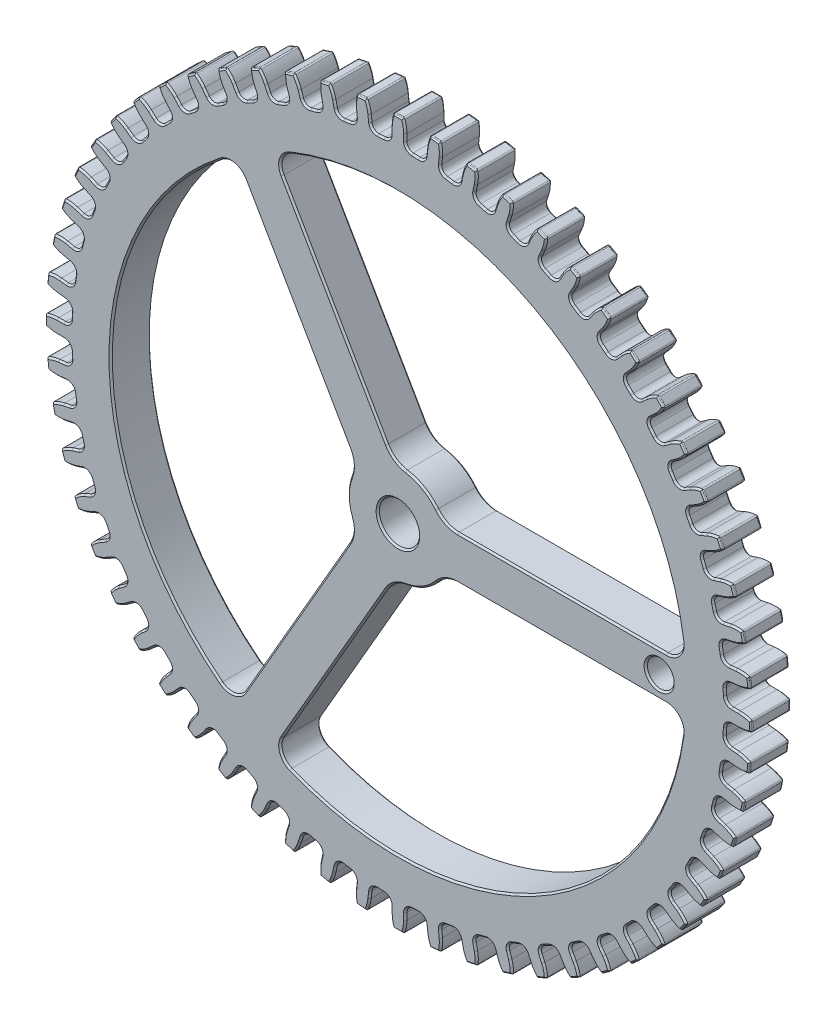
SolidWorks part; units mm, degrees
ref_plane "Спереди" through (0, 0, 0) normal (0, 0, 1) x (1, 0, 0)
ref_plane "Сверху" through (0, 0, 0) normal (0, 1, 0) x (1, 0, 0)
ref_plane "Справа" through (0, 0, 0) normal (1, 0, 0) x (0, 0, -1)
sketch "Эскиз1" plane through (0, 0, 0) normal (0, 0, 1) x (1, 0, 0)
  line L0 (0, 0) -> (0, 52.7) construction
  line L1 (0, 0) -> (-24.4375, 42.327) construction
  line L2 (-7.278, 6.1058) -> (-22.8555, 33.0868)
  line L3 (8.9268, 3.25) -> (40.0817, 3.25)
  line L4 (-1.6488, 9.3558) -> (-17.2263, 36.3368)
  line L5 (8.9268, -3.25) -> (40.0817, -3.25)
  line L6 (-1.6488, -9.3558) -> (-17.2263, -36.3368)
  line L7 (-7.278, -6.1058) -> (-22.8555, -33.0868)
  line L8 (0, 0) -> (42.878, 0) construction
  line L9 (0, 0) -> (-21.439, -37.1334) construction
  line L11 (-1.1, 49.8308) -> (-1.1, 50.8507)
  line L12 (1.1, 49.8308) -> (1.1, 50.8507)
  line L13 (4.1148, 49.6728) -> (4.2214, 50.6871)
  line L14 (6.3027, 49.4428) -> (6.4093, 50.4571)
  line L15 (9.2844, 48.9706) -> (9.4965, 49.9682)
  line L16 (11.4364, 48.5131) -> (11.6484, 49.5108)
  line L17 (14.3524, 47.7318) -> (14.6676, 48.7018)
  line L18 (16.4447, 47.052) -> (16.7599, 48.0219)
  line L19 (19.2631, 45.9701) -> (19.6779, 46.9018)
  line L20 (21.2729, 45.0753) -> (21.6877, 46.007)
  line L21 (23.9628, 43.7047) -> (24.4727, 44.588)
  line L22 (25.868, 42.6047) -> (26.378, 43.488)
  line L23 (28.3999, 40.9605) -> (28.9994, 41.7856)
  line L24 (30.1797, 39.6674) -> (30.7792, 40.4925)
  line L25 (32.5258, 37.7675) -> (33.2083, 38.5255)
  line L26 (34.1608, 36.2954) -> (34.8432, 37.0534)
  line L27 (36.2954, 34.1608) -> (37.0534, 34.8432)
  line L28 (37.7675, 32.5258) -> (38.5255, 33.2083)
  line L29 (39.6674, 30.1797) -> (40.4925, 30.7792)
  line L30 (40.9605, 28.3999) -> (41.7856, 28.9994)
  line L31 (42.6047, 25.868) -> (43.488, 26.378)
  line L32 (43.7047, 23.9628) -> (44.588, 24.4727)
  line L33 (45.0753, 21.2729) -> (46.007, 21.6877)
  line L34 (45.9701, 19.2631) -> (46.9018, 19.6779)
  line L35 (47.052, 16.4447) -> (48.0219, 16.7599)
  line L36 (47.7318, 14.3524) -> (48.7018, 14.6676)
  line L37 (48.5131, 11.4364) -> (49.5108, 11.6484)
  line L38 (48.9706, 9.2844) -> (49.9682, 9.4965)
  line L39 (49.4428, 6.3027) -> (50.4571, 6.4093)
  line L40 (49.6728, 4.1148) -> (50.6871, 4.2214)
  line L41 (49.8308, 1.1) -> (50.8507, 1.1)
  line L42 (49.8308, -1.1) -> (50.8507, -1.1)
  line L43 (49.6728, -4.1148) -> (50.6871, -4.2214)
  line L44 (49.4428, -6.3027) -> (50.4571, -6.4093)
  line L45 (48.9706, -9.2844) -> (49.9682, -9.4965)
  line L46 (48.5131, -11.4364) -> (49.5108, -11.6484)
  line L47 (47.7318, -14.3524) -> (48.7018, -14.6676)
  line L48 (47.052, -16.4447) -> (48.0219, -16.7599)
  line L49 (45.9701, -19.2631) -> (46.9018, -19.6779)
  line L50 (45.0753, -21.2729) -> (46.007, -21.6877)
  line L51 (43.7047, -23.9628) -> (44.588, -24.4727)
  line L52 (42.6047, -25.868) -> (43.488, -26.378)
  line L53 (40.9605, -28.3999) -> (41.7856, -28.9994)
  line L54 (39.6674, -30.1797) -> (40.4925, -30.7792)
  line L55 (37.7675, -32.5258) -> (38.5255, -33.2083)
  line L56 (36.2954, -34.1608) -> (37.0534, -34.8432)
  line L57 (34.1608, -36.2954) -> (34.8432, -37.0534)
  line L58 (32.5258, -37.7675) -> (33.2083, -38.5255)
  line L59 (30.1797, -39.6674) -> (30.7792, -40.4925)
  line L60 (28.3999, -40.9605) -> (28.9994, -41.7856)
  line L61 (25.868, -42.6047) -> (26.378, -43.488)
  line L62 (23.9628, -43.7047) -> (24.4727, -44.588)
  line L63 (21.2729, -45.0753) -> (21.6877, -46.007)
  line L64 (19.2631, -45.9701) -> (19.6779, -46.9018)
  line L65 (16.4447, -47.052) -> (16.7599, -48.0219)
  line L66 (14.3524, -47.7318) -> (14.6676, -48.7018)
  line L67 (11.4364, -48.5131) -> (11.6484, -49.5108)
  line L68 (9.2844, -48.9706) -> (9.4965, -49.9682)
  line L69 (6.3027, -49.4428) -> (6.4093, -50.4571)
  line L70 (4.1148, -49.6728) -> (4.2214, -50.6871)
  line L71 (1.1, -49.8308) -> (1.1, -50.8507)
  line L72 (-1.1, -49.8308) -> (-1.1, -50.8507)
  line L73 (-4.1148, -49.6728) -> (-4.2214, -50.6871)
  line L74 (-6.3027, -49.4428) -> (-6.4093, -50.4571)
  line L75 (-9.2844, -48.9706) -> (-9.4965, -49.9682)
  line L76 (-11.4364, -48.5131) -> (-11.6484, -49.5108)
  line L77 (-14.3524, -47.7318) -> (-14.6676, -48.7018)
  line L78 (-16.4447, -47.052) -> (-16.7599, -48.0219)
  line L79 (-19.2631, -45.9701) -> (-19.6779, -46.9018)
  line L80 (-21.2729, -45.0753) -> (-21.6877, -46.007)
  line L81 (-23.9628, -43.7047) -> (-24.4727, -44.588)
  line L82 (-25.868, -42.6047) -> (-26.378, -43.488)
  line L83 (-28.3999, -40.9605) -> (-28.9994, -41.7856)
  line L84 (-30.1797, -39.6674) -> (-30.7792, -40.4925)
  line L85 (-32.5258, -37.7675) -> (-33.2083, -38.5255)
  line L86 (-34.1608, -36.2954) -> (-34.8432, -37.0534)
  line L87 (-36.2954, -34.1608) -> (-37.0534, -34.8432)
  line L88 (-37.7675, -32.5258) -> (-38.5255, -33.2083)
  line L89 (-39.6674, -30.1797) -> (-40.4925, -30.7792)
  line L90 (-40.9605, -28.3999) -> (-41.7856, -28.9994)
  line L91 (-42.6047, -25.868) -> (-43.488, -26.378)
  line L92 (-43.7047, -23.9628) -> (-44.588, -24.4727)
  line L93 (-45.0753, -21.2729) -> (-46.007, -21.6877)
  line L94 (-45.9701, -19.2631) -> (-46.9018, -19.6779)
  line L95 (-47.052, -16.4447) -> (-48.0219, -16.7599)
  line L96 (-47.7318, -14.3524) -> (-48.7018, -14.6676)
  line L97 (-48.5131, -11.4364) -> (-49.5108, -11.6484)
  line L98 (-48.9706, -9.2844) -> (-49.9682, -9.4965)
  line L99 (-49.4428, -6.3027) -> (-50.4571, -6.4093)
  line L100 (-49.6728, -4.1148) -> (-50.6871, -4.2214)
  line L101 (-49.8308, -1.1) -> (-50.8507, -1.1)
  line L102 (-49.8308, 1.1) -> (-50.8507, 1.1)
  line L103 (-49.6728, 4.1148) -> (-50.6871, 4.2214)
  line L104 (-49.4428, 6.3027) -> (-50.4571, 6.4093)
  line L105 (-48.9706, 9.2844) -> (-49.9682, 9.4965)
  line L106 (-48.5131, 11.4364) -> (-49.5108, 11.6484)
  line L107 (-47.7318, 14.3524) -> (-48.7018, 14.6676)
  line L108 (-47.052, 16.4447) -> (-48.0219, 16.7599)
  line L109 (-45.9701, 19.2631) -> (-46.9018, 19.6779)
  line L110 (-45.0753, 21.2729) -> (-46.007, 21.6877)
  line L111 (-43.7047, 23.9628) -> (-44.588, 24.4727)
  line L112 (-42.6047, 25.868) -> (-43.488, 26.378)
  line L113 (-40.9605, 28.3999) -> (-41.7856, 28.9994)
  line L114 (-39.6674, 30.1797) -> (-40.4925, 30.7792)
  line L115 (-37.7675, 32.5258) -> (-38.5255, 33.2083)
  line L116 (-36.2954, 34.1608) -> (-37.0534, 34.8432)
  line L117 (-34.1608, 36.2954) -> (-34.8432, 37.0534)
  line L118 (-32.5258, 37.7675) -> (-33.2083, 38.5255)
  line L119 (-30.1797, 39.6674) -> (-30.7792, 40.4925)
  line L120 (-28.3999, 40.9605) -> (-28.9994, 41.7856)
  line L121 (-25.868, 42.6047) -> (-26.378, 43.488)
  line L122 (-23.9628, 43.7047) -> (-24.4727, 44.588)
  line L123 (-21.2729, 45.0753) -> (-21.6877, 46.007)
  line L124 (-19.2631, 45.9701) -> (-19.6779, 46.9018)
  line L125 (-16.4447, 47.052) -> (-16.7599, 48.0219)
  line L126 (-14.3524, 47.7318) -> (-14.6676, 48.7018)
  line L127 (-11.4364, 48.5131) -> (-11.6484, 49.5108)
  line L128 (-9.2844, 48.9706) -> (-9.4965, 49.9682)
  line L129 (-6.3027, 49.4428) -> (-6.4093, 50.4571)
  line L130 (-4.1148, 49.6728) -> (-4.2214, 50.6871)
  arc A0 (0.7475, 52.6947) -> (-0.7475, 52.6947) centre (0, 0) ccw
  circle A1 centre (0, 0) radius 51 construction
  arc A2 (-2.0579, 48.8317) -> (-3.0577, 48.7793) centre (0, 0) ccw
  circle A3 centre (0, 0) radius 3
  arc A4 (1.1839, -7.406) -> (5.8218, -4.7283) centre (0, 0) ccw
  arc A5 (42.4582, 5.985) -> (-16.046, 39.7624) centre (0, 0) ccw
  arc A6 (-7.0057, 2.6777) -> (-7.0057, -2.6777) centre (0, 0) ccw
  arc A7 (5.8218, 4.7283) -> (1.1839, 7.406) centre (0, 0) ccw
  arc A8 (-16.046, -39.7624) -> (42.4582, -5.985) centre (0, 0) ccw
  arc A9 (-26.4123, 33.7774) -> (-26.4123, -33.7774) centre (0, 0) ccw
  arc A10 (-22.8555, -33.0868) -> (-26.4123, -33.7774) centre (-24.9339, -31.8868) cw
  arc A11 (-17.2263, -36.3368) -> (-16.046, -39.7624) centre (-15.1478, -37.5368) ccw
  arc A12 (40.0817, -3.25) -> (42.4582, -5.985) centre (40.0817, -5.65) cw
  arc A13 (40.0817, 3.25) -> (42.4582, 5.985) centre (40.0817, 5.65) ccw
  arc A14 (-17.2263, 36.3368) -> (-16.046, 39.7624) centre (-15.1478, 37.5368) cw
  arc A15 (-22.8555, 33.0868) -> (-26.4123, 33.7774) centre (-24.9339, 31.8868) ccw
  arc A16 (-1.6488, -9.3558) -> (1.1839, -7.406) centre (1.8153, -11.3558) cw
  arc A17 (8.9268, -3.25) -> (5.8218, -4.7283) centre (8.9268, -7.25) ccw
  arc A18 (-7.278, -6.1058) -> (-7.0057, -2.6777) centre (-10.7421, -4.1058) ccw
  arc A19 (-7.278, 6.1058) -> (-7.0057, 2.6777) centre (-10.7421, 4.1058) cw
  arc A20 (-1.6488, 9.3558) -> (1.1839, 7.406) centre (1.8153, 11.3558) ccw
  arc A21 (8.9268, 3.25) -> (5.8218, 4.7283) centre (8.9268, 7.25) cw
  arc A22 (-0.7475, 52.6947) -> (-1.1, 50.8507) centre (3.9, 50.8507) ccw
  arc A23 (0.7475, 52.6947) -> (1.1, 50.8507) centre (-3.9, 50.8507) cw
  arc A24 (6.2515, 52.3279) -> (4.7647, 52.4842) centre (0, 0) ccw
  arc A25 (4.7647, 52.4842) -> (4.2214, 50.6871) centre (9.194, 50.1644) ccw
  arc A26 (6.2515, 52.3279) -> (6.4093, 50.4571) centre (1.4367, 50.9798) cw
  arc A27 (11.687, 51.3878) -> (10.2246, 51.6986) centre (0, 0) ccw
  arc A28 (10.2246, 51.6986) -> (9.4965, 49.9682) centre (14.3872, 48.9286) ccw
  arc A29 (11.687, 51.3878) -> (11.6484, 49.5108) centre (6.7577, 50.5503) cw
  arc A30 (16.9945, 49.8846) -> (15.5726, 50.3466) centre (0, 0) ccw
  arc A31 (15.5726, 50.3466) -> (14.6676, 48.7018) centre (19.4228, 47.1567) ccw
  arc A32 (16.9945, 49.8846) -> (16.7599, 48.0219) centre (12.0046, 49.567) cw
  arc A33 (22.1158, 47.835) -> (20.75, 48.443) centre (0, 0) ccw
  arc A34 (20.75, 48.443) -> (19.6779, 46.9018) centre (24.2457, 44.8681) ccw
  arc A35 (22.1158, 47.835) -> (21.6877, 46.007) centre (17.12, 48.0407) cw
  arc A36 (26.9947, 45.2612) -> (25.7, 46.0087) centre (0, 0) ccw
  arc A37 (25.7, 46.0087) -> (24.4727, 44.588) centre (28.8028, 42.088) ccw
  arc A38 (26.9947, 45.2612) -> (26.378, 43.488) centre (22.0478, 45.988) cw
  arc A39 (31.5779, 42.1915) -> (30.3684, 43.0703) centre (0, 0) ccw
  arc A40 (30.3684, 43.0703) -> (28.9994, 41.7856) centre (33.0444, 38.8467) ccw
  arc A41 (31.5779, 42.1915) -> (30.7792, 40.4925) centre (26.7341, 43.4314) cw
  arc A42 (35.8152, 38.6596) -> (34.7041, 39.66) centre (0, 0) ccw
  arc A43 (34.7041, 39.66) -> (33.2083, 38.5255) centre (36.924, 35.1798) ccw
  arc A44 (35.8152, 38.6596) -> (34.8432, 37.0534) centre (31.1275, 40.399) cw
  arc A45 (39.66, 34.7041) -> (38.6596, 35.8152) centre (0, 0) ccw
  arc A46 (38.6596, 35.8152) -> (37.0534, 34.8432) centre (40.399, 31.1275) ccw
  arc A47 (39.66, 34.7041) -> (38.5255, 33.2083) centre (35.1798, 36.924) cw
  arc A48 (43.0703, 30.3684) -> (42.1915, 31.5779) centre (0, 0) ccw
  arc A49 (42.1915, 31.5779) -> (40.4925, 30.7792) centre (43.4314, 26.7341) ccw
  arc A50 (43.0703, 30.3684) -> (41.7856, 28.9994) centre (38.8467, 33.0444) cw
  arc A51 (46.0087, 25.7) -> (45.2612, 26.9947) centre (0, 0) ccw
  arc A52 (45.2612, 26.9947) -> (43.488, 26.378) centre (45.988, 22.0478) ccw
  arc A53 (46.0087, 25.7) -> (44.588, 24.4727) centre (42.088, 28.8028) cw
  arc A54 (48.443, 20.75) -> (47.835, 22.1158) centre (0, 0) ccw
  arc A55 (47.835, 22.1158) -> (46.007, 21.6877) centre (48.0407, 17.12) ccw
  arc A56 (48.443, 20.75) -> (46.9018, 19.6779) centre (44.8681, 24.2457) cw
  arc A57 (50.3466, 15.5726) -> (49.8846, 16.9945) centre (0, 0) ccw
  arc A58 (49.8846, 16.9945) -> (48.0219, 16.7599) centre (49.567, 12.0046) ccw
  arc A59 (50.3466, 15.5726) -> (48.7018, 14.6676) centre (47.1567, 19.4228) cw
  arc A60 (51.6986, 10.2246) -> (51.3878, 11.687) centre (0, 0) ccw
  arc A61 (51.3878, 11.687) -> (49.5108, 11.6484) centre (50.5503, 6.7577) ccw
  arc A62 (51.6986, 10.2246) -> (49.9682, 9.4965) centre (48.9286, 14.3872) cw
  arc A63 (52.4842, 4.7647) -> (52.3279, 6.2515) centre (0, 0) ccw
  arc A64 (52.3279, 6.2515) -> (50.4571, 6.4093) centre (50.9798, 1.4367) ccw
  arc A65 (52.4842, 4.7647) -> (50.6871, 4.2214) centre (50.1644, 9.194) cw
  arc A66 (52.6947, -0.7475) -> (52.6947, 0.7475) centre (0, 0) ccw
  arc A67 (52.6947, 0.7475) -> (50.8507, 1.1) centre (50.8507, -3.9) ccw
  arc A68 (52.6947, -0.7475) -> (50.8507, -1.1) centre (50.8507, 3.9) cw
  arc A69 (52.3279, -6.2515) -> (52.4842, -4.7647) centre (0, 0) ccw
  arc A70 (52.4842, -4.7647) -> (50.6871, -4.2214) centre (50.1644, -9.194) ccw
  arc A71 (52.3279, -6.2515) -> (50.4571, -6.4093) centre (50.9798, -1.4367) cw
  arc A72 (51.3878, -11.687) -> (51.6986, -10.2246) centre (0, 0) ccw
  arc A73 (51.6986, -10.2246) -> (49.9682, -9.4965) centre (48.9286, -14.3872) ccw
  arc A74 (51.3878, -11.687) -> (49.5108, -11.6484) centre (50.5503, -6.7577) cw
  arc A75 (49.8846, -16.9945) -> (50.3466, -15.5726) centre (0, 0) ccw
  arc A76 (50.3466, -15.5726) -> (48.7018, -14.6676) centre (47.1567, -19.4228) ccw
  arc A77 (49.8846, -16.9945) -> (48.0219, -16.7599) centre (49.567, -12.0046) cw
  arc A78 (47.835, -22.1158) -> (48.443, -20.75) centre (0, 0) ccw
  arc A79 (48.443, -20.75) -> (46.9018, -19.6779) centre (44.8681, -24.2457) ccw
  arc A80 (47.835, -22.1158) -> (46.007, -21.6877) centre (48.0407, -17.12) cw
  arc A81 (45.2612, -26.9947) -> (46.0087, -25.7) centre (0, 0) ccw
  arc A82 (46.0087, -25.7) -> (44.588, -24.4727) centre (42.088, -28.8028) ccw
  arc A83 (45.2612, -26.9947) -> (43.488, -26.378) centre (45.988, -22.0478) cw
  arc A84 (42.1915, -31.5779) -> (43.0703, -30.3684) centre (0, 0) ccw
  arc A85 (43.0703, -30.3684) -> (41.7856, -28.9994) centre (38.8467, -33.0444) ccw
  arc A86 (42.1915, -31.5779) -> (40.4925, -30.7792) centre (43.4314, -26.7341) cw
  arc A87 (38.6596, -35.8152) -> (39.66, -34.7041) centre (0, 0) ccw
  arc A88 (39.66, -34.7041) -> (38.5255, -33.2083) centre (35.1798, -36.924) ccw
  arc A89 (38.6596, -35.8152) -> (37.0534, -34.8432) centre (40.399, -31.1275) cw
  arc A90 (34.7041, -39.66) -> (35.8152, -38.6596) centre (0, 0) ccw
  arc A91 (35.8152, -38.6596) -> (34.8432, -37.0534) centre (31.1275, -40.399) ccw
  arc A92 (34.7041, -39.66) -> (33.2083, -38.5255) centre (36.924, -35.1798) cw
  arc A93 (30.3684, -43.0703) -> (31.5779, -42.1915) centre (0, 0) ccw
  arc A94 (31.5779, -42.1915) -> (30.7792, -40.4925) centre (26.7341, -43.4314) ccw
  arc A95 (30.3684, -43.0703) -> (28.9994, -41.7856) centre (33.0444, -38.8467) cw
  arc A96 (25.7, -46.0087) -> (26.9947, -45.2612) centre (0, 0) ccw
  arc A97 (26.9947, -45.2612) -> (26.378, -43.488) centre (22.0478, -45.988) ccw
  arc A98 (25.7, -46.0087) -> (24.4727, -44.588) centre (28.8028, -42.088) cw
  arc A99 (20.75, -48.443) -> (22.1158, -47.835) centre (0, 0) ccw
  arc A100 (22.1158, -47.835) -> (21.6877, -46.007) centre (17.12, -48.0407) ccw
  arc A101 (20.75, -48.443) -> (19.6779, -46.9018) centre (24.2457, -44.8681) cw
  arc A102 (15.5726, -50.3466) -> (16.9945, -49.8846) centre (0, 0) ccw
  arc A103 (16.9945, -49.8846) -> (16.7599, -48.0219) centre (12.0046, -49.567) ccw
  arc A104 (15.5726, -50.3466) -> (14.6676, -48.7018) centre (19.4228, -47.1567) cw
  arc A105 (10.2246, -51.6986) -> (11.687, -51.3878) centre (0, 0) ccw
  arc A106 (11.687, -51.3878) -> (11.6484, -49.5108) centre (6.7577, -50.5503) ccw
  arc A107 (10.2246, -51.6986) -> (9.4965, -49.9682) centre (14.3872, -48.9286) cw
  arc A108 (4.7647, -52.4842) -> (6.2515, -52.3279) centre (0, 0) ccw
  arc A109 (6.2515, -52.3279) -> (6.4093, -50.4571) centre (1.4367, -50.9798) ccw
  arc A110 (4.7647, -52.4842) -> (4.2214, -50.6871) centre (9.194, -50.1644) cw
  arc A111 (-0.7475, -52.6947) -> (0.7475, -52.6947) centre (0, 0) ccw
  arc A112 (0.7475, -52.6947) -> (1.1, -50.8507) centre (-3.9, -50.8507) ccw
  arc A113 (-0.7475, -52.6947) -> (-1.1, -50.8507) centre (3.9, -50.8507) cw
  arc A114 (-6.2515, -52.3279) -> (-4.7647, -52.4842) centre (0, 0) ccw
  arc A115 (-4.7647, -52.4842) -> (-4.2214, -50.6871) centre (-9.194, -50.1644) ccw
  arc A116 (-6.2515, -52.3279) -> (-6.4093, -50.4571) centre (-1.4367, -50.9798) cw
  arc A117 (-11.687, -51.3878) -> (-10.2246, -51.6986) centre (0, 0) ccw
  arc A118 (-10.2246, -51.6986) -> (-9.4965, -49.9682) centre (-14.3872, -48.9286) ccw
  arc A119 (-11.687, -51.3878) -> (-11.6484, -49.5108) centre (-6.7577, -50.5503) cw
  arc A120 (-16.9945, -49.8846) -> (-15.5726, -50.3466) centre (0, 0) ccw
  arc A121 (-15.5726, -50.3466) -> (-14.6676, -48.7018) centre (-19.4228, -47.1567) ccw
  arc A122 (-16.9945, -49.8846) -> (-16.7599, -48.0219) centre (-12.0046, -49.567) cw
  arc A123 (-22.1158, -47.835) -> (-20.75, -48.443) centre (0, 0) ccw
  arc A124 (-20.75, -48.443) -> (-19.6779, -46.9018) centre (-24.2457, -44.8681) ccw
  arc A125 (-22.1158, -47.835) -> (-21.6877, -46.007) centre (-17.12, -48.0407) cw
  arc A126 (-26.9947, -45.2612) -> (-25.7, -46.0087) centre (0, 0) ccw
  arc A127 (-25.7, -46.0087) -> (-24.4727, -44.588) centre (-28.8028, -42.088) ccw
  arc A128 (-26.9947, -45.2612) -> (-26.378, -43.488) centre (-22.0478, -45.988) cw
  arc A129 (-31.5779, -42.1915) -> (-30.3684, -43.0703) centre (0, 0) ccw
  arc A130 (-30.3684, -43.0703) -> (-28.9994, -41.7856) centre (-33.0444, -38.8467) ccw
  arc A131 (-31.5779, -42.1915) -> (-30.7792, -40.4925) centre (-26.7341, -43.4314) cw
  arc A132 (-35.8152, -38.6596) -> (-34.7041, -39.66) centre (0, 0) ccw
  arc A133 (-34.7041, -39.66) -> (-33.2083, -38.5255) centre (-36.924, -35.1798) ccw
  arc A134 (-35.8152, -38.6596) -> (-34.8432, -37.0534) centre (-31.1275, -40.399) cw
  arc A135 (-39.66, -34.7041) -> (-38.6596, -35.8152) centre (0, 0) ccw
  arc A136 (-38.6596, -35.8152) -> (-37.0534, -34.8432) centre (-40.399, -31.1275) ccw
  arc A137 (-39.66, -34.7041) -> (-38.5255, -33.2083) centre (-35.1798, -36.924) cw
  arc A138 (-43.0703, -30.3684) -> (-42.1915, -31.5779) centre (0, 0) ccw
  arc A139 (-42.1915, -31.5779) -> (-40.4925, -30.7792) centre (-43.4314, -26.7341) ccw
  arc A140 (-43.0703, -30.3684) -> (-41.7856, -28.9994) centre (-38.8467, -33.0444) cw
  arc A141 (-46.0087, -25.7) -> (-45.2612, -26.9947) centre (0, 0) ccw
  arc A142 (-45.2612, -26.9947) -> (-43.488, -26.378) centre (-45.988, -22.0478) ccw
  arc A143 (-46.0087, -25.7) -> (-44.588, -24.4727) centre (-42.088, -28.8028) cw
  arc A144 (-48.443, -20.75) -> (-47.835, -22.1158) centre (0, 0) ccw
  arc A145 (-47.835, -22.1158) -> (-46.007, -21.6877) centre (-48.0407, -17.12) ccw
  arc A146 (-48.443, -20.75) -> (-46.9018, -19.6779) centre (-44.8681, -24.2457) cw
  arc A147 (-50.3466, -15.5726) -> (-49.8846, -16.9945) centre (0, 0) ccw
  arc A148 (-49.8846, -16.9945) -> (-48.0219, -16.7599) centre (-49.567, -12.0046) ccw
  arc A149 (-50.3466, -15.5726) -> (-48.7018, -14.6676) centre (-47.1567, -19.4228) cw
  arc A150 (-51.6986, -10.2246) -> (-51.3878, -11.687) centre (0, 0) ccw
  arc A151 (-51.3878, -11.687) -> (-49.5108, -11.6484) centre (-50.5503, -6.7577) ccw
  arc A152 (-51.6986, -10.2246) -> (-49.9682, -9.4965) centre (-48.9286, -14.3872) cw
  arc A153 (-52.4842, -4.7647) -> (-52.3279, -6.2515) centre (0, 0) ccw
  arc A154 (-52.3279, -6.2515) -> (-50.4571, -6.4093) centre (-50.9798, -1.4367) ccw
  arc A155 (-52.4842, -4.7647) -> (-50.6871, -4.2214) centre (-50.1644, -9.194) cw
  arc A156 (-52.6947, 0.7475) -> (-52.6947, -0.7475) centre (0, 0) ccw
  arc A157 (-52.6947, -0.7475) -> (-50.8507, -1.1) centre (-50.8507, 3.9) ccw
  arc A158 (-52.6947, 0.7475) -> (-50.8507, 1.1) centre (-50.8507, -3.9) cw
  arc A159 (-52.3279, 6.2515) -> (-52.4842, 4.7647) centre (0, 0) ccw
  arc A160 (-52.4842, 4.7647) -> (-50.6871, 4.2214) centre (-50.1644, 9.194) ccw
  arc A161 (-52.3279, 6.2515) -> (-50.4571, 6.4093) centre (-50.9798, 1.4367) cw
  arc A162 (-51.3878, 11.687) -> (-51.6986, 10.2246) centre (0, 0) ccw
  arc A163 (-51.6986, 10.2246) -> (-49.9682, 9.4965) centre (-48.9286, 14.3872) ccw
  arc A164 (-51.3878, 11.687) -> (-49.5108, 11.6484) centre (-50.5503, 6.7577) cw
  arc A165 (-49.8846, 16.9945) -> (-50.3466, 15.5726) centre (0, 0) ccw
  arc A166 (-50.3466, 15.5726) -> (-48.7018, 14.6676) centre (-47.1567, 19.4228) ccw
  arc A167 (-49.8846, 16.9945) -> (-48.0219, 16.7599) centre (-49.567, 12.0046) cw
  arc A168 (-47.835, 22.1158) -> (-48.443, 20.75) centre (0, 0) ccw
  arc A169 (-48.443, 20.75) -> (-46.9018, 19.6779) centre (-44.8681, 24.2457) ccw
  arc A170 (-47.835, 22.1158) -> (-46.007, 21.6877) centre (-48.0407, 17.12) cw
  arc A171 (-45.2612, 26.9947) -> (-46.0087, 25.7) centre (0, 0) ccw
  arc A172 (-46.0087, 25.7) -> (-44.588, 24.4727) centre (-42.088, 28.8028) ccw
  arc A173 (-45.2612, 26.9947) -> (-43.488, 26.378) centre (-45.988, 22.0478) cw
  arc A174 (-42.1915, 31.5779) -> (-43.0703, 30.3684) centre (0, 0) ccw
  arc A175 (-43.0703, 30.3684) -> (-41.7856, 28.9994) centre (-38.8467, 33.0444) ccw
  arc A176 (-42.1915, 31.5779) -> (-40.4925, 30.7792) centre (-43.4314, 26.7341) cw
  arc A177 (-38.6596, 35.8152) -> (-39.66, 34.7041) centre (0, 0) ccw
  arc A178 (-39.66, 34.7041) -> (-38.5255, 33.2083) centre (-35.1798, 36.924) ccw
  arc A179 (-38.6596, 35.8152) -> (-37.0534, 34.8432) centre (-40.399, 31.1275) cw
  arc A180 (-34.7041, 39.66) -> (-35.8152, 38.6596) centre (0, 0) ccw
  arc A181 (-35.8152, 38.6596) -> (-34.8432, 37.0534) centre (-31.1275, 40.399) ccw
  arc A182 (-34.7041, 39.66) -> (-33.2083, 38.5255) centre (-36.924, 35.1798) cw
  arc A183 (-30.3684, 43.0703) -> (-31.5779, 42.1915) centre (0, 0) ccw
  arc A184 (-31.5779, 42.1915) -> (-30.7792, 40.4925) centre (-26.7341, 43.4314) ccw
  arc A185 (-30.3684, 43.0703) -> (-28.9994, 41.7856) centre (-33.0444, 38.8467) cw
  arc A186 (-25.7, 46.0087) -> (-26.9947, 45.2612) centre (0, 0) ccw
  arc A187 (-26.9947, 45.2612) -> (-26.378, 43.488) centre (-22.0478, 45.988) ccw
  arc A188 (-25.7, 46.0087) -> (-24.4727, 44.588) centre (-28.8028, 42.088) cw
  arc A189 (-20.75, 48.443) -> (-22.1158, 47.835) centre (0, 0) ccw
  arc A190 (-22.1158, 47.835) -> (-21.6877, 46.007) centre (-17.12, 48.0407) ccw
  arc A191 (-20.75, 48.443) -> (-19.6779, 46.9018) centre (-24.2457, 44.8681) cw
  arc A192 (-15.5726, 50.3466) -> (-16.9945, 49.8846) centre (0, 0) ccw
  arc A193 (-16.9945, 49.8846) -> (-16.7599, 48.0219) centre (-12.0046, 49.567) ccw
  arc A194 (-15.5726, 50.3466) -> (-14.6676, 48.7018) centre (-19.4228, 47.1567) cw
  arc A195 (-10.2246, 51.6986) -> (-11.687, 51.3878) centre (0, 0) ccw
  arc A196 (-11.687, 51.3878) -> (-11.6484, 49.5108) centre (-6.7577, 50.5503) ccw
  arc A197 (-10.2246, 51.6986) -> (-9.4965, 49.9682) centre (-14.3872, 48.9286) cw
  arc A198 (-4.7647, 52.4842) -> (-6.2515, 52.3279) centre (0, 0) ccw
  arc A199 (-6.2515, 52.3279) -> (-6.4093, 50.4571) centre (-1.4367, 50.9798) ccw
  arc A200 (-4.7647, 52.4842) -> (-4.2214, 50.6871) centre (-9.194, 50.1644) cw
  arc A201 (3.0577, 48.7793) -> (2.0579, 48.8317) centre (0, 0) ccw
  arc A202 (8.1397, 48.1924) -> (7.1509, 48.349) centre (0, 0) ccw
  arc A203 (-7.1509, 48.349) -> (-8.1397, 48.1924) centre (0, 0) ccw
  arc A204 (-12.1656, 47.3367) -> (-13.1326, 47.0776) centre (0, 0) ccw
  arc A205 (-17.047, 45.8057) -> (-17.9816, 45.447) centre (0, 0) ccw
  arc A206 (13.1326, 47.0776) -> (12.1656, 47.3367) centre (0, 0) ccw
  arc A207 (17.9816, 45.447) -> (17.047, 45.8057) centre (0, 0) ccw
  arc A208 (22.6336, 43.3184) -> (21.7416, 43.7729) centre (0, 0) ccw
  arc A209 (-21.7416, 43.7729) -> (-22.6336, 43.3184) centre (0, 0) ccw
  arc A210 (-26.198, 41.2605) -> (-27.0377, 40.7152) centre (0, 0) ccw
  arc A211 (-37.666, 31.1454) -> (-38.296, 30.3674) centre (0, 0) ccw
  arc A212 (-34.2041, 34.912) -> (-34.912, 34.2041) centre (0, 0) ccw
  arc A213 (-30.3674, 38.296) -> (-31.1454, 37.666) centre (0, 0) ccw
  arc A214 (-43.3184, 22.6336) -> (-43.7729, 21.7416) centre (0, 0) ccw
  arc A215 (-40.7152, 27.0377) -> (-41.2605, 26.198) centre (0, 0) ccw
  arc A216 (-45.447, 17.9816) -> (-45.8057, 17.047) centre (0, 0) ccw
  arc A217 (-47.0776, 13.1326) -> (-47.3367, 12.1656) centre (0, 0) ccw
  arc A218 (-48.1924, 8.1397) -> (-48.349, 7.1509) centre (0, 0) ccw
  arc A219 (-48.7793, 3.0577) -> (-48.8317, 2.0579) centre (0, 0) ccw
  arc A220 (-48.8317, -2.0579) -> (-48.7793, -3.0577) centre (0, 0) ccw
  arc A221 (-48.349, -7.1509) -> (-48.1924, -8.1397) centre (0, 0) ccw
  arc A222 (-47.3367, -12.1656) -> (-47.0776, -13.1326) centre (0, 0) ccw
  arc A223 (-45.8057, -17.047) -> (-45.447, -17.9816) centre (0, 0) ccw
  arc A224 (-43.7729, -21.7416) -> (-43.3184, -22.6336) centre (0, 0) ccw
  arc A225 (-41.2605, -26.198) -> (-40.7152, -27.0377) centre (0, 0) ccw
  arc A226 (-38.296, -30.3674) -> (-37.666, -31.1454) centre (0, 0) ccw
  arc A227 (-34.912, -34.2041) -> (-34.2041, -34.912) centre (0, 0) ccw
  arc A228 (-31.1454, -37.666) -> (-30.3674, -38.296) centre (0, 0) ccw
  arc A229 (-27.0377, -40.7152) -> (-26.198, -41.2605) centre (0, 0) ccw
  arc A230 (-22.6336, -43.3184) -> (-21.7416, -43.7729) centre (0, 0) ccw
  arc A231 (-17.9816, -45.447) -> (-17.047, -45.8057) centre (0, 0) ccw
  arc A232 (-13.1326, -47.0776) -> (-12.1656, -47.3367) centre (0, 0) ccw
  arc A233 (-8.1397, -48.1924) -> (-7.1509, -48.349) centre (0, 0) ccw
  arc A234 (-3.0577, -48.7793) -> (-2.0579, -48.8317) centre (0, 0) ccw
  arc A235 (2.0579, -48.8317) -> (3.0577, -48.7793) centre (0, 0) ccw
  arc A236 (7.1509, -48.349) -> (8.1397, -48.1924) centre (0, 0) ccw
  arc A237 (12.1656, -47.3367) -> (13.1326, -47.0776) centre (0, 0) ccw
  arc A238 (17.047, -45.8057) -> (17.9816, -45.447) centre (0, 0) ccw
  arc A239 (21.7416, -43.7729) -> (22.6336, -43.3184) centre (0, 0) ccw
  arc A240 (26.198, -41.2605) -> (27.0377, -40.7152) centre (0, 0) ccw
  arc A241 (30.3674, -38.296) -> (31.1454, -37.666) centre (0, 0) ccw
  arc A242 (34.2041, -34.912) -> (34.912, -34.2041) centre (0, 0) ccw
  arc A243 (37.666, -31.1454) -> (38.296, -30.3674) centre (0, 0) ccw
  arc A244 (40.7152, -27.0377) -> (41.2605, -26.198) centre (0, 0) ccw
  arc A245 (43.3184, -22.6336) -> (43.7729, -21.7416) centre (0, 0) ccw
  arc A246 (45.447, -17.9816) -> (45.8057, -17.047) centre (0, 0) ccw
  arc A247 (47.0776, -13.1326) -> (47.3367, -12.1656) centre (0, 0) ccw
  arc A248 (48.1924, -8.1397) -> (48.349, -7.1509) centre (0, 0) ccw
  arc A249 (43.7729, 21.7416) -> (43.3184, 22.6336) centre (0, 0) ccw
  arc A250 (45.8057, 17.047) -> (45.447, 17.9816) centre (0, 0) ccw
  arc A251 (47.3367, 12.1656) -> (47.0776, 13.1326) centre (0, 0) ccw
  arc A252 (48.349, 7.1509) -> (48.1924, 8.1397) centre (0, 0) ccw
  arc A253 (48.8317, 2.0579) -> (48.7793, 3.0577) centre (0, 0) ccw
  arc A254 (48.7793, -3.0577) -> (48.8317, -2.0579) centre (0, 0) ccw
  arc A255 (41.2605, 26.198) -> (40.7152, 27.0377) centre (0, 0) ccw
  arc A256 (38.296, 30.3674) -> (37.666, 31.1454) centre (0, 0) ccw
  arc A257 (34.912, 34.2041) -> (34.2041, 34.912) centre (0, 0) ccw
  arc A258 (31.1454, 37.666) -> (30.3674, 38.296) centre (0, 0) ccw
  arc A259 (27.0377, 40.7152) -> (26.198, 41.2605) centre (0, 0) ccw
  arc A260 (-45.9701, 19.2631) -> (-45.447, 17.9816) centre (-46.3768, 18.3496) cw
  arc A261 (-47.052, 16.4447) -> (-45.8057, 17.047) centre (-46.7429, 17.3958) ccw
  arc A262 (-45.0753, 21.2729) -> (-43.7729, 21.7416) centre (-44.6685, 22.1864) ccw
  arc A263 (-43.7047, 23.9628) -> (-43.3184, 22.6336) centre (-44.2047, 23.0967) cw
  arc A264 (-42.6047, 25.868) -> (-41.2605, 26.198) centre (-42.1047, 26.734) ccw
  arc A265 (-40.9605, 28.3999) -> (-40.7152, 27.0377) centre (-41.5483, 27.5909) cw
  arc A266 (-39.6674, 30.1797) -> (-38.296, 30.3674) centre (-39.0796, 30.9887) ccw
  arc A267 (-37.7675, 32.5258) -> (-37.666, 31.1454) centre (-38.4367, 31.7827) cw
  arc A268 (-36.2954, 34.1608) -> (-34.912, 34.2041) centre (-35.6263, 34.9039) ccw
  arc A269 (-34.1608, 36.2954) -> (-34.2041, 34.912) centre (-34.9039, 35.6263) cw
  arc A270 (-32.5258, 37.7675) -> (-31.1454, 37.666) centre (-31.7827, 38.4367) ccw
  arc A271 (-30.1797, 39.6674) -> (-30.3674, 38.296) centre (-30.9887, 39.0796) cw
  arc A272 (-28.3999, 40.9605) -> (-27.0377, 40.7152) centre (-27.5909, 41.5483) ccw
  arc A273 (-25.868, 42.6047) -> (-26.198, 41.2605) centre (-26.734, 42.1047) cw
  arc A274 (-23.9628, 43.7047) -> (-22.6336, 43.3184) centre (-23.0967, 44.2047) ccw
  arc A275 (-21.2729, 45.0753) -> (-21.7416, 43.7729) centre (-22.1864, 44.6685) cw
  arc A276 (-19.2631, 45.9701) -> (-17.9816, 45.447) centre (-18.3496, 46.3768) ccw
  arc A277 (-16.4447, 47.052) -> (-17.047, 45.8057) centre (-17.3958, 46.7429) cw
  arc A278 (-47.7318, 14.3524) -> (-47.0776, 13.1326) centre (-48.0408, 13.4013) cw
  arc A279 (-48.5131, 11.4364) -> (-47.3367, 12.1656) centre (-48.3052, 12.4145) ccw
  arc A280 (-48.9706, 9.2844) -> (-48.1924, 8.1397) centre (-49.1785, 8.3063) cw
  arc A281 (-49.6728, 4.1148) -> (-48.7793, 3.0577) centre (-49.7773, 3.1202) cw
  arc A282 (-49.4428, 6.3027) -> (-48.349, 7.1509) centre (-49.3383, 7.2972) ccw
  arc A283 (-49.8308, 1.1) -> (-48.8317, 2.0579) centre (-49.8308, 2.1) ccw
  arc A284 (-49.8308, -1.1) -> (-48.8317, -2.0579) centre (-49.8308, -2.1) cw
  arc A285 (-49.6728, -4.1148) -> (-48.7793, -3.0577) centre (-49.7773, -3.1202) ccw
  arc A286 (-49.4428, -6.3027) -> (-48.349, -7.1509) centre (-49.3383, -7.2972) cw
  arc A287 (-48.9706, -9.2844) -> (-48.1924, -8.1397) centre (-49.1785, -8.3063) ccw
  arc A288 (-47.7318, -14.3524) -> (-47.0776, -13.1326) centre (-48.0408, -13.4013) ccw
  arc A289 (-48.5131, -11.4364) -> (-47.3367, -12.1656) centre (-48.3052, -12.4145) cw
  arc A290 (-47.052, -16.4447) -> (-45.8057, -17.047) centre (-46.7429, -17.3958) cw
  arc A291 (-45.9701, -19.2631) -> (-45.447, -17.9816) centre (-46.3768, -18.3496) ccw
  arc A292 (-45.0753, -21.2729) -> (-43.7729, -21.7416) centre (-44.6685, -22.1864) cw
  arc A293 (-43.7047, -23.9628) -> (-43.3184, -22.6336) centre (-44.2047, -23.0967) ccw
  arc A294 (-42.6047, -25.868) -> (-41.2605, -26.198) centre (-42.1047, -26.734) cw
  arc A295 (-40.9605, -28.3999) -> (-40.7152, -27.0377) centre (-41.5483, -27.5909) ccw
  arc A296 (-37.7675, -32.5258) -> (-37.666, -31.1454) centre (-38.4367, -31.7827) ccw
  arc A297 (-39.6674, -30.1797) -> (-38.296, -30.3674) centre (-39.0796, -30.9887) cw
  arc A298 (-36.2954, -34.1608) -> (-34.912, -34.2041) centre (-35.6263, -34.9039) cw
  arc A299 (-34.1608, -36.2954) -> (-34.2041, -34.912) centre (-34.9039, -35.6263) ccw
  arc A300 (-32.5258, -37.7675) -> (-31.1454, -37.666) centre (-31.7827, -38.4367) cw
  arc A301 (-30.1797, -39.6674) -> (-30.3674, -38.296) centre (-30.9887, -39.0796) ccw
  arc A302 (-25.868, -42.6047) -> (-26.198, -41.2605) centre (-26.734, -42.1047) ccw
  arc A303 (-28.3999, -40.9605) -> (-27.0377, -40.7152) centre (-27.5909, -41.5483) cw
  arc A304 (-23.9628, -43.7047) -> (-22.6336, -43.3184) centre (-23.0967, -44.2047) cw
  arc A305 (-21.2729, -45.0753) -> (-21.7416, -43.7729) centre (-22.1864, -44.6685) ccw
  arc A306 (-14.3524, -47.7318) -> (-13.1326, -47.0776) centre (-13.4013, -48.0408) cw
  arc A307 (-16.4447, -47.052) -> (-17.047, -45.8057) centre (-17.3958, -46.7429) ccw
  arc A308 (-19.2631, -45.9701) -> (-17.9816, -45.447) centre (-18.3496, -46.3768) cw
  arc A309 (-11.4364, -48.5131) -> (-12.1656, -47.3367) centre (-12.4145, -48.3052) ccw
  arc A310 (-9.2844, -48.9706) -> (-8.1397, -48.1924) centre (-8.3063, -49.1785) cw
  arc A311 (-6.3027, -49.4428) -> (-7.1509, -48.349) centre (-7.2972, -49.3383) ccw
  arc A312 (-4.1148, -49.6728) -> (-3.0577, -48.7793) centre (-3.1202, -49.7773) cw
  arc A313 (-1.1, -49.8308) -> (-2.0579, -48.8317) centre (-2.1, -49.8308) ccw
  arc A314 (1.1, -49.8308) -> (2.0579, -48.8317) centre (2.1, -49.8308) cw
  arc A315 (4.1148, -49.6728) -> (3.0577, -48.7793) centre (3.1202, -49.7773) ccw
  arc A316 (6.3027, -49.4428) -> (7.1509, -48.349) centre (7.2972, -49.3383) cw
  arc A317 (9.2844, -48.9706) -> (8.1397, -48.1924) centre (8.3063, -49.1785) ccw
  arc A318 (11.4364, -48.5131) -> (12.1656, -47.3367) centre (12.4145, -48.3052) cw
  arc A319 (14.3524, -47.7318) -> (13.1326, -47.0776) centre (13.4013, -48.0408) ccw
  arc A320 (16.4447, -47.052) -> (17.047, -45.8057) centre (17.3958, -46.7429) cw
  arc A321 (19.2631, -45.9701) -> (17.9816, -45.447) centre (18.3496, -46.3768) ccw
  arc A322 (21.2729, -45.0753) -> (21.7416, -43.7729) centre (22.1864, -44.6685) cw
  arc A323 (23.9628, -43.7047) -> (22.6336, -43.3184) centre (23.0967, -44.2047) ccw
  arc A324 (25.868, -42.6047) -> (26.198, -41.2605) centre (26.734, -42.1047) cw
  arc A325 (28.3999, -40.9605) -> (27.0377, -40.7152) centre (27.5909, -41.5483) ccw
  arc A326 (30.1797, -39.6674) -> (30.3674, -38.296) centre (30.9887, -39.0796) cw
  arc A327 (32.5258, -37.7675) -> (31.1454, -37.666) centre (31.7827, -38.4367) ccw
  arc A328 (34.1608, -36.2954) -> (34.2041, -34.912) centre (34.9039, -35.6263) cw
  arc A329 (36.2954, -34.1608) -> (34.912, -34.2041) centre (35.6263, -34.9039) ccw
  arc A330 (37.7675, -32.5258) -> (37.666, -31.1454) centre (38.4367, -31.7827) cw
  arc A331 (39.6674, -30.1797) -> (38.296, -30.3674) centre (39.0796, -30.9887) ccw
  arc A332 (40.9605, -28.3999) -> (40.7152, -27.0377) centre (41.5483, -27.5909) cw
  arc A333 (42.6047, -25.868) -> (41.2605, -26.198) centre (42.1047, -26.734) ccw
  arc A334 (43.7047, -23.9628) -> (43.3184, -22.6336) centre (44.2047, -23.0967) cw
  arc A335 (45.0753, -21.2729) -> (43.7729, -21.7416) centre (44.6685, -22.1864) ccw
  arc A336 (45.9701, -19.2631) -> (45.447, -17.9816) centre (46.3768, -18.3496) cw
  arc A337 (47.052, -16.4447) -> (45.8057, -17.047) centre (46.7429, -17.3958) ccw
  arc A338 (47.7318, -14.3524) -> (47.0776, -13.1326) centre (48.0408, -13.4013) cw
  arc A339 (48.5131, -11.4364) -> (47.3367, -12.1656) centre (48.3052, -12.4145) ccw
  arc A340 (48.9706, -9.2844) -> (48.1924, -8.1397) centre (49.1785, -8.3063) cw
  arc A341 (49.4428, -6.3027) -> (48.349, -7.1509) centre (49.3383, -7.2972) ccw
  arc A342 (49.6728, -4.1148) -> (48.7793, -3.0577) centre (49.7773, -3.1202) cw
  arc A343 (49.8308, -1.1) -> (48.8317, -2.0579) centre (49.8308, -2.1) ccw
  arc A344 (49.8308, 1.1) -> (48.8317, 2.0579) centre (49.8308, 2.1) cw
  arc A345 (49.6728, 4.1148) -> (48.7793, 3.0577) centre (49.7773, 3.1202) ccw
  arc A346 (49.4428, 6.3027) -> (48.349, 7.1509) centre (49.3383, 7.2972) cw
  arc A347 (48.9706, 9.2844) -> (48.1924, 8.1397) centre (49.1785, 8.3063) ccw
  arc A348 (48.5131, 11.4364) -> (47.3367, 12.1656) centre (48.3052, 12.4145) cw
  arc A349 (47.7318, 14.3524) -> (47.0776, 13.1326) centre (48.0408, 13.4013) ccw
  arc A350 (47.052, 16.4447) -> (45.8057, 17.047) centre (46.7429, 17.3958) cw
  arc A351 (45.9701, 19.2631) -> (45.447, 17.9816) centre (46.3768, 18.3496) ccw
  arc A352 (45.0753, 21.2729) -> (43.7729, 21.7416) centre (44.6685, 22.1864) cw
  arc A353 (43.7047, 23.9628) -> (43.3184, 22.6336) centre (44.2047, 23.0967) ccw
  arc A354 (42.6047, 25.868) -> (41.2605, 26.198) centre (42.1047, 26.734) cw
  arc A355 (40.9605, 28.3999) -> (40.7152, 27.0377) centre (41.5483, 27.5909) ccw
  arc A356 (39.6674, 30.1797) -> (38.296, 30.3674) centre (39.0796, 30.9887) cw
  arc A357 (37.7675, 32.5258) -> (37.666, 31.1454) centre (38.4367, 31.7827) ccw
  arc A358 (36.2954, 34.1608) -> (34.912, 34.2041) centre (35.6263, 34.9039) cw
  arc A359 (34.1608, 36.2954) -> (34.2041, 34.912) centre (34.9039, 35.6263) ccw
  arc A360 (32.5258, 37.7675) -> (31.1454, 37.666) centre (31.7827, 38.4367) cw
  arc A361 (30.1797, 39.6674) -> (30.3674, 38.296) centre (30.9887, 39.0796) ccw
  arc A362 (25.868, 42.6047) -> (26.198, 41.2605) centre (26.734, 42.1047) ccw
  arc A363 (28.3999, 40.9605) -> (27.0377, 40.7152) centre (27.5909, 41.5483) cw
  arc A364 (23.9628, 43.7047) -> (22.6336, 43.3184) centre (23.0967, 44.2047) cw
  arc A365 (21.2729, 45.0753) -> (21.7416, 43.7729) centre (22.1864, 44.6685) ccw
  arc A366 (19.2631, 45.9701) -> (17.9816, 45.447) centre (18.3496, 46.3768) cw
  arc A367 (16.4447, 47.052) -> (17.047, 45.8057) centre (17.3958, 46.7429) ccw
  arc A368 (14.3524, 47.7318) -> (13.1326, 47.0776) centre (13.4013, 48.0408) cw
  arc A369 (11.4364, 48.5131) -> (12.1656, 47.3367) centre (12.4145, 48.3052) ccw
  arc A370 (9.2844, 48.9706) -> (8.1397, 48.1924) centre (8.3063, 49.1785) cw
  arc A371 (6.3027, 49.4428) -> (7.1509, 48.349) centre (7.2972, 49.3383) ccw
  arc A372 (4.1148, 49.6728) -> (3.0577, 48.7793) centre (3.1202, 49.7773) cw
  arc A373 (1.1, 49.8308) -> (2.0579, 48.8317) centre (2.1, 49.8308) ccw
  arc A374 (-14.3524, 47.7318) -> (-13.1326, 47.0776) centre (-13.4013, 48.0408) ccw
  arc A375 (-11.4364, 48.5131) -> (-12.1656, 47.3367) centre (-12.4145, 48.3052) cw
  arc A376 (-9.2844, 48.9706) -> (-8.1397, 48.1924) centre (-8.3063, 49.1785) ccw
  arc A377 (-6.3027, 49.4428) -> (-7.1509, 48.349) centre (-7.2972, 49.3383) cw
  arc A378 (-1.1, 49.8308) -> (-2.0579, 48.8317) centre (-2.1, 49.8308) cw
  arc A379 (-4.1148, 49.6728) -> (-3.0577, 48.7793) centre (-3.1202, 49.7773) ccw
  point P1 (-0.7475, 52.6947)
  point P36 (-24.1919, 35.4016)
  point P45 (-6.1942, 4.2287)
  point P63 (4.7647, 52.4842)
  point P73 (10.2246, 51.6986)
  point P83 (15.5726, 50.3466)
  point P93 (20.75, 48.443)
  point P103 (25.7, 46.0087)
  point P113 (30.3684, 43.0703)
  point P123 (34.7041, 39.66)
  point P133 (38.6596, 35.8152)
  point P143 (42.1915, 31.5779)
  point P153 (45.2612, 26.9947)
  point P163 (47.835, 22.1158)
  point P173 (49.8846, 16.9945)
  point P183 (51.3878, 11.687)
  point P193 (52.3279, 6.2515)
  point P203 (52.6947, 0.7475)
  point P213 (52.4842, -4.7647)
  point P223 (51.6986, -10.2246)
  point P233 (50.3466, -15.5726)
  point P243 (48.443, -20.75)
  point P253 (46.0087, -25.7)
  point P263 (43.0703, -30.3684)
  point P273 (39.66, -34.7041)
  point P283 (35.8152, -38.6596)
  point P293 (31.5779, -42.1915)
  point P303 (26.9947, -45.2612)
  point P313 (22.1158, -47.835)
  point P323 (16.9945, -49.8846)
  point P333 (11.687, -51.3878)
  point P343 (6.2515, -52.3279)
  point P353 (0.7475, -52.6947)
  point P363 (-4.7647, -52.4842)
  point P373 (-10.2246, -51.6986)
  point P383 (-15.5726, -50.3466)
  point P393 (-20.75, -48.443)
  point P403 (-25.7, -46.0087)
  point P413 (-30.3684, -43.0703)
  point P423 (-34.7041, -39.66)
  point P433 (-38.6596, -35.8152)
  point P443 (-42.1915, -31.5779)
  point P453 (-45.2612, -26.9947)
  point P463 (-47.835, -22.1158)
  point P473 (-49.8846, -16.9945)
  point P483 (-51.3878, -11.687)
  point P493 (-52.3279, -6.2515)
  point P503 (-52.6947, -0.7475)
  point P513 (-52.4842, 4.7647)
  point P523 (-51.6986, 10.2246)
  point P533 (-50.3466, 15.5726)
  point P543 (-48.443, 20.75)
  point P553 (-46.0087, 25.7)
  point P563 (-43.0703, 30.3684)
  point P573 (-39.66, 34.7041)
  point P583 (-35.8152, 38.6596)
  point P593 (-31.5779, 42.1915)
  point P603 (-26.9947, 45.2612)
  point P613 (-22.1158, 47.835)
  point P623 (-16.9945, 49.8846)
  point P633 (-11.687, 51.3878)
  point P643 (-6.2515, 52.3279)
  point P873 (1.1, 48.8626)
  point P884 (-1.1, 48.8626)
  dimension "D1" = 105.4
  dimension "D2" = 102
  dimension "D3" = 97.75
  dimension "D4" = 6
  dimension "D5" = 15
  dimension "D8" = 85.756
  dimension "D6" = 2.4
  dimension "D13" = 4
  dimension "D14" = 10
  dimension "D17" = 1
  dimension "D7" = 3.25
  dimension "D9" = 3.25
  dimension "D11" = 3.25
  dimension "D12" = 6.5
  dimension "D15" = 2.2
  dimension "D16" = 60
  dimension "D10" = 3
extrude "Бобышка-Вытянуть1" add sketch "Эскиз1" along normal blind 6
chamfer "Фаска1" distance 0.25 angle 45 400 edges at (21.439, 37.1334, 6) (-17.4169, 38.3186, 6) (-9.4375, 22.8463, 6) (-0.4527, 8.0609, 6) (3.75, 6.4952, 6) (7.2073, 3.6384, 6) (24.5043, 3.25, 6) (41.8934, 4.0758, 6) (-15.0667, -19.5963, 6) (-6.7546, -4.4225, 6) (-7.5, 0, 6) (-6.7546, 4.4225, 6) (-15.0667, 19.5963, 6) (-24.4765, 34.2428, 6) (-42.878, 0, 6) (-24.4765, -34.2428, 6) (-46.4359, 19.4705, 6) (-47.7232, 20.141, 6) (-48.1438, 21.435, 6) (-46.9007, 21.9883, 6) (-45.5411, 21.4803, 6) (-44.3299, 21.2455, 6) (-43.5479, 22.1888, 6) (-43.2445, 23.3758, 6) (-44.1463, 24.2177, 6) (-45.3565, 25.0191, 6) (-45.6395, 26.35, 6) (-44.3454, 26.7703, 6) (-43.0463, 26.123, 6) (-41.8663, 25.7629, 6) (-40.99, 26.6192, 6) (-40.5641, 27.7681, 6) (-41.3731, 28.6996, 6) (-42.4928, 29.623, 6) (-42.6352, 30.9763, 6) (-41.3042, 31.259, 6) (-40.0799, 30.4794, 6) (-38.944, 29.998, 6) (-37.983, 30.758, 6) (-37.4393, 31.856, 6) (-38.1465, 32.8671, 6) (-39.1636, 33.9025, 6) (-39.1637, 35.2632, 6) (-37.8105, 35.4052, 6) (-36.6744, 34.502, 6) (-35.595, 33.9044, 6) (-34.5598, 34.5598, 6) (-33.9044, 35.595, 6) (-34.502, 36.6744, 6) (-35.4052, 37.8105, 6) (-35.2632, 39.1637, 6) (-33.9025, 39.1636, 6) (-32.8671, 38.1465, 6) (-31.856, 37.4393, 6) (-30.758, 37.983, 6) (-29.998, 38.944, 6) (-30.4794, 40.0799, 6) (-31.259, 41.3042, 6) (-30.9763, 42.6352, 6) (-29.623, 42.4928, 6) (-28.6996, 41.3731, 6) (-27.7681, 40.5641, 6) (-26.6192, 40.99, 6) (-25.7629, 41.8663, 6) (-26.123, 43.0463, 6) (-26.7703, 44.3454, 6) (-26.35, 45.6395, 6) (-25.0191, 45.3565, 6) (-24.2177, 44.1463, 6) (-23.3758, 43.2445, 6) (-22.1888, 43.5479, 6) (-21.2455, 44.3299, 6) (-21.4803, 45.5411, 6) (-21.9883, 46.9007, 6) (-21.435, 48.1438, 6) (-20.141, 47.7232, 6) (-19.4705, 46.4359, 6) (-18.7275, 45.451, 6) (-17.5152, 45.6287, 6) (-16.4954, 46.3078, 6) (-16.6023, 47.5369, 6) (-16.9654, 48.9422, 6) (-16.2852, 50.1207, 6) (-15.0422, 49.5671, 6) (-14.51, 48.2168, 6) (-13.874, 47.1596, 6) (-12.6498, 47.2096, 6) (-11.5646, 47.7784, 6) (-11.5424, 49.0119, 6) (-11.7566, 50.4474, 6) (-10.9569, 51.5484, 6) (-9.7786, 50.8679, 6) (-9.3905, 49.4694, 6) (-8.8685, 48.3514, 6) (-7.6457, 48.2733, 6) (-6.507, 48.7255, 6) (-6.356, 49.95, 6) (-6.419, 51.4, 6) (-5.5087, 52.4113, 6) (-4.4079, 51.6114, 6) (-4.1681, 50.1799, 6) (-3.7658, 49.0136, 6) (-2.5579, 48.808, 6) (-1.3782, 49.1387, 6) (-1.1, 50.3407, 6) (-1.0111, 51.7894, 6) (0, 52.7, 6) (1.0111, 51.7894, 6) (1.1, 50.3407, 6) (1.3782, 49.1387, 6) (2.5579, 48.808, 6) (3.7658, 49.0136, 6) (4.1681, 50.1799, 6) (4.4079, 51.6114, 6) (5.5087, 52.4113, 6) (6.419, 51.4, 6) (6.356, 49.95, 6) (6.507, 48.7255, 6) (7.6457, 48.2733, 6) (8.8685, 48.3514, 6) (9.3905, 49.4694, 6) (9.7786, 50.8679, 6) (10.9569, 51.5484, 6) (11.7566, 50.4474, 6) (11.5424, 49.0119, 6) (11.5646, 47.7784, 6) (12.6498, 47.2096, 6) (13.874, 47.1596, 6) (14.51, 48.2168, 6) (15.0422, 49.5671, 6) (16.2852, 50.1207, 6) (16.9654, 48.9422, 6) (16.6023, 47.5369, 6) (16.4954, 46.3078, 6) (17.5152, 45.6287, 6) (18.7275, 45.451, 6) (19.4705, 46.4359, 6) (20.141, 47.7232, 6) (21.435, 48.1438, 6) (21.9883, 46.9007, 6) (21.4803, 45.5411, 6) (21.2455, 44.3299, 6) (22.1888, 43.5479, 6) (23.3758, 43.2445, 6) (24.2177, 44.1463, 6) (25.0191, 45.3565, 6) (26.35, 45.6395, 6) (26.7703, 44.3454, 6) (26.123, 43.0463, 6) (25.7629, 41.8663, 6) (26.6192, 40.99, 6) (27.7681, 40.5641, 6) (28.6996, 41.3731, 6) (29.623, 42.4928, 6) (30.9763, 42.6352, 6) (31.259, 41.3042, 6) (30.4794, 40.0799, 6) (29.998, 38.944, 6) (30.758, 37.983, 6) (31.856, 37.4393, 6) (32.8671, 38.1465, 6) (33.9025, 39.1636, 6) (35.2632, 39.1637, 6) (35.4052, 37.8105, 6) (34.502, 36.6744, 6) (33.9044, 35.595, 6) (34.5598, 34.5598, 6) (35.595, 33.9044, 6) (36.6744, 34.502, 6) (37.8105, 35.4052, 6) (39.1637, 35.2632, 6) (39.1636, 33.9025, 6) (38.1465, 32.8671, 6) (37.4393, 31.856, 6) (37.983, 30.758, 6) (38.944, 29.998, 6) (40.0799, 30.4794, 6) (41.3042, 31.259, 6) (42.6352, 30.9763, 6) (42.4928, 29.623, 6) (41.3731, 28.6996, 6) (40.5641, 27.7681, 6) (40.99, 26.6192, 6) (41.8663, 25.7629, 6) (43.0463, 26.123, 6) (44.3454, 26.7703, 6) (45.6395, 26.35, 6) (45.3565, 25.0191, 6) (44.1463, 24.2177, 6) (43.2445, 23.3758, 6) (43.5479, 22.1888, 6) (44.3299, 21.2455, 6) (45.5411, 21.4803, 6) (46.9007, 21.9883, 6) (48.1438, 21.435, 6) (47.7232, 20.141, 6) (46.4359, 19.4705, 6) (45.451, 18.7275, 6) (45.6287, 17.5152, 6) (46.3078, 16.4954, 6) (47.5369, 16.6023, 6) (48.9422, 16.9654, 6) (50.1207, 16.2852, 6) (49.5671, 15.0422, 6) (48.2168, 14.51, 6) (47.1596, 13.874, 6) (47.2096, 12.6498, 6) (47.7784, 11.5646, 6) (49.0119, 11.5424, 6) (50.4474, 11.7566, 6) (51.5484, 10.9569, 6) (50.8679, 9.7786, 6) (49.4694, 9.3905, 6) (48.3514, 8.8685, 6) (48.2733, 7.6457, 6) (48.7255, 6.507, 6) (49.95, 6.356, 6) (51.4, 6.419, 6) (52.4113, 5.5087, 6) (51.6114, 4.4079, 6) (50.1799, 4.1681, 6) (49.0136, 3.7658, 6) (48.808, 2.5579, 6) (49.1387, 1.3782, 6) (50.3407, 1.1, 6) (51.7894, 1.0111, 6) (52.7, 0, 6) (51.7894, -1.0111, 6) (50.3407, -1.1, 6) (49.1387, -1.3782, 6) (48.808, -2.5579, 6) (49.0136, -3.7658, 6) (50.1799, -4.1681, 6) (51.6114, -4.4079, 6) (52.4113, -5.5087, 6) (51.4, -6.419, 6) (49.95, -6.356, 6) (48.7255, -6.507, 6) (48.2733, -7.6457, 6) (48.3514, -8.8685, 6) (49.4694, -9.3905, 6) (50.8679, -9.7786, 6) (51.5484, -10.9569, 6) (50.4474, -11.7566, 6) (49.0119, -11.5424, 6) (47.7784, -11.5646, 6) (47.2096, -12.6498, 6) (47.1596, -13.874, 6) (48.2168, -14.51, 6) (49.5671, -15.0422, 6) (50.1207, -16.2852, 6) (48.9422, -16.9654, 6) (47.5369, -16.6023, 6) (46.3078, -16.4954, 6) (45.6287, -17.5152, 6) (45.451, -18.7275, 6) (46.4359, -19.4705, 6) (47.7232, -20.141, 6) (48.1438, -21.435, 6) (46.9007, -21.9883, 6) (45.5411, -21.4803, 6) (44.3299, -21.2455, 6) (43.5479, -22.1888, 6) (43.2445, -23.3758, 6) (44.1463, -24.2177, 6) (45.3565, -25.0191, 6) (45.6395, -26.35, 6) (44.3454, -26.7703, 6) (43.0463, -26.123, 6) (41.8663, -25.7629, 6) (40.99, -26.6192, 6) (40.5641, -27.7681, 6) (41.3731, -28.6996, 6) (42.4928, -29.623, 6) (42.6352, -30.9763, 6) (41.3042, -31.259, 6) (40.0799, -30.4794, 6) (38.944, -29.998, 6) (37.983, -30.758, 6) (37.4393, -31.856, 6) (38.1465, -32.8671, 6) (39.1636, -33.9025, 6) (39.1637, -35.2632, 6) (37.8105, -35.4052, 6) (36.6744, -34.502, 6) (35.595, -33.9044, 6) (34.5598, -34.5598, 6) (33.9044, -35.595, 6) (34.502, -36.6744, 6) (35.4052, -37.8105, 6) (35.2632, -39.1637, 6) (33.9025, -39.1636, 6) (32.8671, -38.1465, 6) (31.856, -37.4393, 6) (30.758, -37.983, 6) (29.998, -38.944, 6) (30.4794, -40.0799, 6) (31.259, -41.3042, 6) (30.9763, -42.6352, 6) (29.623, -42.4928, 6) (28.6996, -41.3731, 6) (27.7681, -40.5641, 6) (26.6192, -40.99, 6) (25.7629, -41.8663, 6) (26.123, -43.0463, 6) (26.7703, -44.3454, 6) (26.35, -45.6395, 6) (25.0191, -45.3565, 6) (24.2177, -44.1463, 6) (23.3758, -43.2445, 6) (22.1888, -43.5479, 6) (21.2455, -44.3299, 6) (21.4803, -45.5411, 6) (21.9883, -46.9007, 6) (21.435, -48.1438, 6) (20.141, -47.7232, 6) (19.4705, -46.4359, 6) (18.7275, -45.451, 6) (17.5152, -45.6287, 6) (16.4954, -46.3078, 6) (16.6023, -47.5369, 6) (16.9654, -48.9422, 6) (16.2852, -50.1207, 6) (15.0422, -49.5671, 6) (14.51, -48.2168, 6) (13.874, -47.1596, 6) (12.6498, -47.2096, 6) (11.5646, -47.7784, 6) (11.5424, -49.0119, 6) (11.7566, -50.4474, 6) (10.9569, -51.5484, 6) (9.7786, -50.8679, 6) (9.3905, -49.4694, 6) (8.8685, -48.3514, 6) (7.6457, -48.2733, 6) (6.507, -48.7255, 6) (6.356, -49.95, 6) (6.419, -51.4, 6) (5.5087, -52.4113, 6) (4.4079, -51.6114, 6) (4.1681, -50.1799, 6) (3.7658, -49.0136, 6) (2.5579, -48.808, 6) (1.3782, -49.1387, 6) (1.1, -50.3407, 6) (1.0111, -51.7894, 6) (0, -52.7, 6) (-1.0111, -51.7894, 6) (-1.1, -50.3407, 6) (-1.3782, -49.1387, 6) (-2.5579, -48.808, 6) (-3.7658, -49.0136, 6) (-4.1681, -50.1799, 6) (-4.4079, -51.6114, 6) (-5.5087, -52.4113, 6) (-6.419, -51.4, 6) (-6.356, -49.95, 6) (-6.507, -48.7255, 6) (-7.6457, -48.2733, 6) (-8.8685, -48.3514, 6) (-9.3905, -49.4694, 6) (-9.7786, -50.8679, 6) (-10.9569, -51.5484, 6) (-11.7566, -50.4474, 6) (-11.5424, -49.0119, 6) (-11.5646, -47.7784, 6) (-12.6498, -47.2096, 6) (-13.874, -47.1596, 6) (-14.51, -48.2168, 6) (-15.0422, -49.5671, 6) (-16.2852, -50.1207, 6) (-16.9654, -48.9422, 6) (-16.6023, -47.5369, 6) (-16.4954, -46.3078, 6) (-17.5152, -45.6287, 6) (-18.7275, -45.451, 6) (-19.4705, -46.4359, 6) (-20.141, -47.7232, 6) (-21.435, -48.1438, 6) (-21.9883, -46.9007, 6) (-21.4803, -45.5411, 6) (-21.2455, -44.3299, 6) (-22.1888, -43.5479, 6) (-23.3758, -43.2445, 6) (-24.2177, -44.1463, 6) (-25.0191, -45.3565, 6) (-26.35, -45.6395, 6) (-26.7703, -44.3454, 6) (-26.123, -43.0463, 6) (-25.7629, -41.8663, 6) (-26.6192, -40.99, 6) (-27.7681, -40.5641, 6) (-28.6996, -41.3731, 6) (-29.623, -42.4928, 6) (-30.9763, -42.6352, 6) (-31.259, -41.3042, 6) (-30.4794, -40.0799, 6) (-29.998, -38.944, 6) (-30.758, -37.983, 6) (-31.856, -37.4393, 6)
chamfer "Фаска2" distance 0.25 angle 45 400 edges at (7.2073, 3.6384, 0) (3.75, 6.4952, 0) (-0.4527, 8.0609, 0) (-9.4375, 22.8463, 0) (-17.4169, 38.3186, 0) (21.439, 37.1334, 0) (41.8934, 4.0758, 0) (24.5043, 3.25, 0) (-24.4765, 34.2428, 0) (-15.0667, 19.5963, 0) (-6.7546, 4.4225, 0) (-7.5, 0, 0) (-6.7546, -4.4225, 0) (-15.0667, -19.5963, 0) (-24.4765, -34.2428, 0) (-42.878, 0, 0) (-45.6287, 17.5152, 0) (-46.3078, 16.4954, 0) (-47.5369, 16.6023, 0) (-48.9422, 16.9654, 0) (-50.1207, 16.2852, 0) (-49.5671, 15.0422, 0) (-48.2168, 14.51, 0) (-47.1596, 13.874, 0) (-47.2096, 12.6498, 0) (-47.7784, 11.5646, 0) (-49.0119, 11.5424, 0) (-50.4474, 11.7566, 0) (-51.5484, 10.9569, 0) (-50.8679, 9.7786, 0) (-49.4694, 9.3905, 0) (-48.3514, 8.8685, 0) (-48.2733, 7.6457, 0) (-48.7255, 6.507, 0) (-49.95, 6.356, 0) (-51.4, 6.419, 0) (-52.4113, 5.5087, 0) (-51.6114, 4.4079, 0) (-50.1799, 4.1681, 0) (-49.0136, 3.7658, 0) (-48.808, 2.5579, 0) (-49.1387, 1.3782, 0) (-50.3407, 1.1, 0) (-51.7894, 1.0111, 0) (-52.7, 0, 0) (-51.7894, -1.0111, 0) (-50.3407, -1.1, 0) (-49.1387, -1.3782, 0) (-48.808, -2.5579, 0) (-49.0136, -3.7658, 0) (-50.1799, -4.1681, 0) (-51.6114, -4.4079, 0) (-52.4113, -5.5087, 0) (-51.4, -6.419, 0) (-49.95, -6.356, 0) (-48.7255, -6.507, 0) (-48.2733, -7.6457, 0) (-48.3514, -8.8685, 0) (-49.4694, -9.3905, 0) (-50.8679, -9.7786, 0) (-51.5484, -10.9569, 0) (-50.4474, -11.7566, 0) (-49.0119, -11.5424, 0) (-47.7784, -11.5646, 0) (-47.2096, -12.6498, 0) (-47.1596, -13.874, 0) (-48.2168, -14.51, 0) (-49.5671, -15.0422, 0) (-50.1207, -16.2852, 0) (-48.9422, -16.9654, 0) (-47.5369, -16.6023, 0) (-46.3078, -16.4954, 0) (-45.6287, -17.5152, 0) (-45.451, -18.7275, 0) (-46.4359, -19.4705, 0) (-47.7232, -20.141, 0) (-48.1438, -21.435, 0) (-46.9007, -21.9883, 0) (-45.5411, -21.4803, 0) (-44.3299, -21.2455, 0) (-43.5479, -22.1888, 0) (-43.2445, -23.3758, 0) (-44.1463, -24.2177, 0) (-45.3565, -25.0191, 0) (-45.6395, -26.35, 0) (-44.3454, -26.7703, 0) (-43.0463, -26.123, 0) (-41.8663, -25.7629, 0) (-40.99, -26.6192, 0) (-40.5641, -27.7681, 0) (-41.3731, -28.6996, 0) (-42.4928, -29.623, 0) (-42.6352, -30.9763, 0) (-41.3042, -31.259, 0) (-40.0799, -30.4794, 0) (-38.944, -29.998, 0) (-37.983, -30.758, 0) (-37.4393, -31.856, 0) (-38.1465, -32.8671, 0) (-39.1636, -33.9025, 0) (-39.1637, -35.2632, 0) (-37.8105, -35.4052, 0) (-36.6744, -34.502, 0) (-35.595, -33.9044, 0) (-34.5598, -34.5598, 0) (-33.9044, -35.595, 0) (-34.502, -36.6744, 0) (-35.4052, -37.8105, 0) (-35.2632, -39.1637, 0) (-33.9025, -39.1636, 0) (-32.8671, -38.1465, 0) (-31.856, -37.4393, 0) (-30.758, -37.983, 0) (-29.998, -38.944, 0) (-30.4794, -40.0799, 0) (-31.259, -41.3042, 0) (-30.9763, -42.6352, 0) (-29.623, -42.4928, 0) (-28.6996, -41.3731, 0) (-27.7681, -40.5641, 0) (-26.6192, -40.99, 0) (-25.7629, -41.8663, 0) (-26.123, -43.0463, 0) (-26.7703, -44.3454, 0) (-26.35, -45.6395, 0) (-25.0191, -45.3565, 0) (-24.2177, -44.1463, 0) (-23.3758, -43.2445, 0) (-22.1888, -43.5479, 0) (-21.2455, -44.3299, 0) (-21.4803, -45.5411, 0) (-21.9883, -46.9007, 0) (-21.435, -48.1438, 0) (-20.141, -47.7232, 0) (-19.4705, -46.4359, 0) (-18.7275, -45.451, 0) (-17.5152, -45.6287, 0) (-16.4954, -46.3078, 0) (-16.6023, -47.5369, 0) (-16.9654, -48.9422, 0) (-16.2852, -50.1207, 0) (-15.0422, -49.5671, 0) (-14.51, -48.2168, 0) (-13.874, -47.1596, 0) (-12.6498, -47.2096, 0) (-11.5646, -47.7784, 0) (-11.5424, -49.0119, 0) (-11.7566, -50.4474, 0) (-10.9569, -51.5484, 0) (-9.7786, -50.8679, 0) (-9.3905, -49.4694, 0) (-8.8685, -48.3514, 0) (-7.6457, -48.2733, 0) (-6.507, -48.7255, 0) (-6.356, -49.95, 0) (-6.419, -51.4, 0) (-5.5087, -52.4113, 0) (-4.4079, -51.6114, 0) (-4.1681, -50.1799, 0) (-3.7658, -49.0136, 0) (-2.5579, -48.808, 0) (-1.3782, -49.1387, 0) (-1.1, -50.3407, 0) (-1.0111, -51.7894, 0) (0, -52.7, 0) (1.0111, -51.7894, 0) (1.1, -50.3407, 0) (1.3782, -49.1387, 0) (2.5579, -48.808, 0) (3.7658, -49.0136, 0) (4.1681, -50.1799, 0) (4.4079, -51.6114, 0) (5.5087, -52.4113, 0) (6.419, -51.4, 0) (6.356, -49.95, 0) (6.507, -48.7255, 0) (7.6457, -48.2733, 0) (8.8685, -48.3514, 0) (9.3905, -49.4694, 0) (9.7786, -50.8679, 0) (10.9569, -51.5484, 0) (11.7566, -50.4474, 0) (11.5424, -49.0119, 0) (11.5646, -47.7784, 0) (12.6498, -47.2096, 0) (13.874, -47.1596, 0) (14.51, -48.2168, 0) (15.0422, -49.5671, 0) (16.2852, -50.1207, 0) (16.9654, -48.9422, 0) (16.6023, -47.5369, 0) (16.4954, -46.3078, 0) (17.5152, -45.6287, 0) (18.7275, -45.451, 0) (19.4705, -46.4359, 0) (20.141, -47.7232, 0) (21.435, -48.1438, 0) (21.9883, -46.9007, 0) (21.4803, -45.5411, 0) (21.2455, -44.3299, 0) (22.1888, -43.5479, 0) (23.3758, -43.2445, 0) (24.2177, -44.1463, 0) (25.0191, -45.3565, 0) (26.35, -45.6395, 0) (26.7703, -44.3454, 0) (26.123, -43.0463, 0) (25.7629, -41.8663, 0) (26.6192, -40.99, 0) (27.7681, -40.5641, 0) (28.6996, -41.3731, 0) (29.623, -42.4928, 0) (30.9763, -42.6352, 0) (31.259, -41.3042, 0) (30.4794, -40.0799, 0) (29.998, -38.944, 0) (30.758, -37.983, 0) (31.856, -37.4393, 0) (32.8671, -38.1465, 0) (33.9025, -39.1636, 0) (35.2632, -39.1637, 0) (35.4052, -37.8105, 0) (34.502, -36.6744, 0) (33.9044, -35.595, 0) (34.5598, -34.5598, 0) (35.595, -33.9044, 0) (36.6744, -34.502, 0) (37.8105, -35.4052, 0) (39.1637, -35.2632, 0) (39.1636, -33.9025, 0) (38.1465, -32.8671, 0) (37.4393, -31.856, 0) (37.983, -30.758, 0) (38.944, -29.998, 0) (40.0799, -30.4794, 0) (41.3042, -31.259, 0) (42.6352, -30.9763, 0) (42.4928, -29.623, 0) (41.3731, -28.6996, 0) (40.5641, -27.7681, 0) (40.99, -26.6192, 0) (41.8663, -25.7629, 0) (43.0463, -26.123, 0) (44.3454, -26.7703, 0) (45.6395, -26.35, 0) (45.3565, -25.0191, 0) (44.1463, -24.2177, 0) (43.2445, -23.3758, 0) (43.5479, -22.1888, 0) (44.3299, -21.2455, 0) (45.5411, -21.4803, 0) (46.9007, -21.9883, 0) (48.1438, -21.435, 0) (47.7232, -20.141, 0) (46.4359, -19.4705, 0) (45.451, -18.7275, 0) (45.6287, -17.5152, 0) (46.3078, -16.4954, 0) (47.5369, -16.6023, 0) (48.9422, -16.9654, 0) (50.1207, -16.2852, 0) (49.5671, -15.0422, 0) (48.2168, -14.51, 0) (47.1596, -13.874, 0) (47.2096, -12.6498, 0) (47.7784, -11.5646, 0) (49.0119, -11.5424, 0) (50.4474, -11.7566, 0) (51.5484, -10.9569, 0) (50.8679, -9.7786, 0) (49.4694, -9.3905, 0) (48.3514, -8.8685, 0) (48.2733, -7.6457, 0) (48.7255, -6.507, 0) (49.95, -6.356, 0) (51.4, -6.419, 0) (52.4113, -5.5087, 0) (51.6114, -4.4079, 0) (50.1799, -4.1681, 0) (49.0136, -3.7658, 0) (48.808, -2.5579, 0) (49.1387, -1.3782, 0) (50.3407, -1.1, 0) (51.7894, -1.0111, 0) (52.7, 0, 0) (51.7894, 1.0111, 0) (50.3407, 1.1, 0) (49.1387, 1.3782, 0) (48.808, 2.5579, 0) (49.0136, 3.7658, 0) (50.1799, 4.1681, 0) (51.6114, 4.4079, 0) (52.4113, 5.5087, 0) (51.4, 6.419, 0) (49.95, 6.356, 0) (48.7255, 6.507, 0) (48.2733, 7.6457, 0) (48.3514, 8.8685, 0) (49.4694, 9.3905, 0) (50.8679, 9.7786, 0) (51.5484, 10.9569, 0) (50.4474, 11.7566, 0) (49.0119, 11.5424, 0) (47.7784, 11.5646, 0) (47.2096, 12.6498, 0) (47.1596, 13.874, 0) (48.2168, 14.51, 0) (49.5671, 15.0422, 0) (50.1207, 16.2852, 0) (48.9422, 16.9654, 0) (47.5369, 16.6023, 0) (46.3078, 16.4954, 0) (45.6287, 17.5152, 0) (45.451, 18.7275, 0) (46.4359, 19.4705, 0) (47.7232, 20.141, 0) (48.1438, 21.435, 0) (46.9007, 21.9883, 0) (45.5411, 21.4803, 0) (44.3299, 21.2455, 0) (43.5479, 22.1888, 0) (43.2445, 23.3758, 0) (44.1463, 24.2177, 0) (45.3565, 25.0191, 0) (45.6395, 26.35, 0) (44.3454, 26.7703, 0) (43.0463, 26.123, 0) (41.8663, 25.7629, 0) (40.99, 26.6192, 0) (40.5641, 27.7681, 0) (41.3731, 28.6996, 0) (42.4928, 29.623, 0) (42.6352, 30.9763, 0) (41.3042, 31.259, 0) (40.0799, 30.4794, 0) (38.944, 29.998, 0) (37.983, 30.758, 0) (37.4393, 31.856, 0) (38.1465, 32.8671, 0) (39.1636, 33.9025, 0) (39.1637, 35.2632, 0) (37.8105, 35.4052, 0) (36.6744, 34.502, 0) (35.595, 33.9044, 0) (34.5598, 34.5598, 0) (33.9044, 35.595, 0) (34.502, 36.6744, 0) (35.4052, 37.8105, 0) (35.2632, 39.1637, 0) (33.9025, 39.1636, 0) (32.8671, 38.1465, 0) (31.856, 37.4393, 0) (30.758, 37.983, 0) (29.998, 38.944, 0) (30.4794, 40.0799, 0) (31.259, 41.3042, 0) (30.9763, 42.6352, 0) (29.623, 42.4928, 0) (28.6996, 41.3731, 0) (27.7681, 40.5641, 0) (26.6192, 40.99, 0) (25.7629, 41.8663, 0) (26.123, 43.0463, 0) (26.7703, 44.3454, 0) (26.35, 45.6395, 0) (25.0191, 45.3565, 0) (24.2177, 44.1463, 0) (23.3758, 43.2445, 0) (22.1888, 43.5479, 0) (21.2455, 44.3299, 0) (21.4803, 45.5411, 0) (21.9883, 46.9007, 0) (21.435, 48.1438, 0) (20.141, 47.7232, 0) (19.4705, 46.4359, 0) (18.7275, 45.451, 0) (17.5152, 45.6287, 0) (16.4954, 46.3078, 0) (16.6023, 47.5369, 0) (16.9654, 48.9422, 0) (16.2852, 50.1207, 0) (15.0422, 49.5671, 0) (14.51, 48.2168, 0) (13.874, 47.1596, 0) (12.6498, 47.2096, 0) (11.5646, 47.7784, 0) (11.5424, 49.0119, 0) (11.7566, 50.4474, 0) (10.9569, 51.5484, 0) (9.7786, 50.8679, 0) (9.3905, 49.4694, 0) (8.8685, 48.3514, 0) (7.6457, 48.2733, 0) (6.507, 48.7255, 0) (6.356, 49.95, 0) (6.419, 51.4, 0) (5.5087, 52.4113, 0) (4.4079, 51.6114, 0) (4.1681, 50.1799, 0) (3.7658, 49.0136, 0)
fillet "Скругление1" radius 0.25 50 edges at (-47.835, -22.1158, 3) (-45.6395, -26.35, 0.25) (-46.0087, -25.7, 3) (-51.3878, -11.687, 3) (-52.4842, -4.7647, 3) (-52.7, 0, 5.75) (-52.4113, 5.5087, 5.75) (-51.3878, 11.687, 3) (-50.1207, 16.2852, 0.25) (-49.8846, 16.9945, 3) (-48.443, 20.75, 3) (-43.0703, 30.3684, 3) (-42.1915, 31.5779, 3) (-15.5726, -50.3466, 3) (-26.9947, -45.2612, 3) (-42.1915, -31.5779, 3) (-38.6596, -35.8152, 3) (-4.7647, -52.4842, 3) (-6.2515, -52.3279, 3) (0.7475, -52.6947, 3) (5.5087, -52.4113, 5.75) (11.687, -51.3878, 3) (21.435, -48.1438, 0.25) (25.7, -46.0087, 3) (35.8152, -38.6596, 3) (34.7041, -39.66, 3) (42.6352, -30.9763, 5.75) (45.6395, -26.35, 0.25) (50.1207, -16.2852, 5.75) (51.3878, -11.687, 3) (52.3279, 6.2515, 3) (52.4113, 5.5087, 0.25) (51.3878, 11.687, 3) (51.5484, 10.9569, 0.25) (50.1207, 16.2852, 5.75) (49.8846, 16.9945, 3) (45.2612, 26.9947, 3) (46.0087, 25.7, 3) (42.6352, 30.9763, 5.75) (43.0703, 30.3684, 3) (39.66, 34.7041, 3) (26.35, 45.6395, 0.25) (21.435, 48.1438, 5.75) (5.5087, 52.4113, 0.25) (6.2515, 52.3279, 3) (-11.687, 51.3878, 3) (-39.1637, 35.2632, 5.75) (-39.66, 34.7041, 3) (-38.6596, 35.8152, 3) (-16.2852, 50.1207, 5.75)
sketch "Эскиз2" plane through (0, 0, 0) normal (0, 0, 1) x (1, 0, 0)
  circle A0 centre (39, 0) radius 2
  dimension "D1" = 4
  dimension "D2" = 39
extrude "Вырез-Вытянуть1" cut sketch "Эскиз2" along normal blind 10
chamfer "Фаска3" distance 0.25 angle 45 2 edges at (37, 0, 6) (41, 0, 0)
